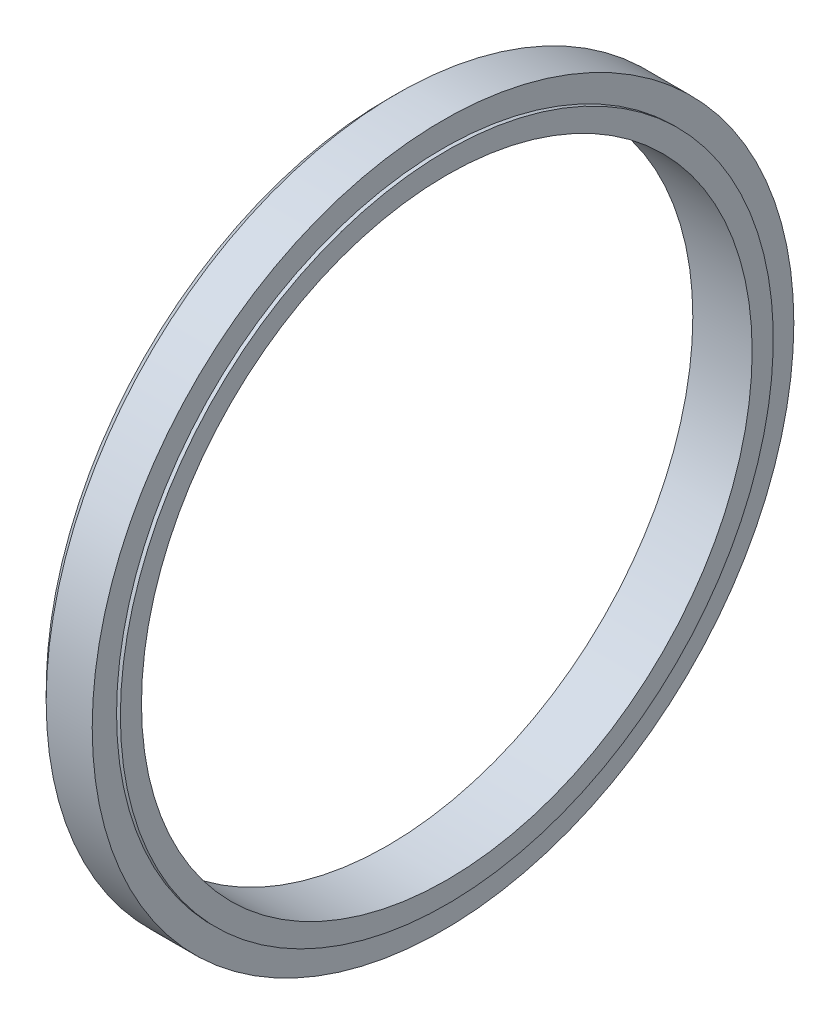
SolidWorks part; units mm, degrees
ref_plane "Front Plane" through (0, 0, 0) normal (0, 0, 1) x (1, 0, 0)
ref_plane "Top Plane" through (0, 0, 0) normal (0, 1, 0) x (1, 0, 0)
ref_plane "Right Plane" through (0, 0, 0) normal (1, 0, 0) x (0, 0, -1)
sketch "Sketch2" plane through (0, 0, 0) normal (0, 0, 1) x (1, 0, 0)
  line L5 (-2.5141, 0) -> (2.0897, 0) construction
  line L7 (0, 8.025) -> (1.56, 8.025)
  line L8 (0, 8.025) -> (0, 9.22)
  line L9 (0, 9.22) -> (1.46, 9.22)
  line L10 (1.56, 8.58) -> (1.56, 8.025)
  line L11 (1.56, 8.58) -> (1.46, 8.58)
  line L12 (1.46, 8.58) -> (1.46, 9.22)
revolve "Revolve1" add sketch "Sketch2" angle 360 about L5
chamfer "Chamfer1" distance 0.25 angle 45 1 edges at (0, 0, 9.22)
